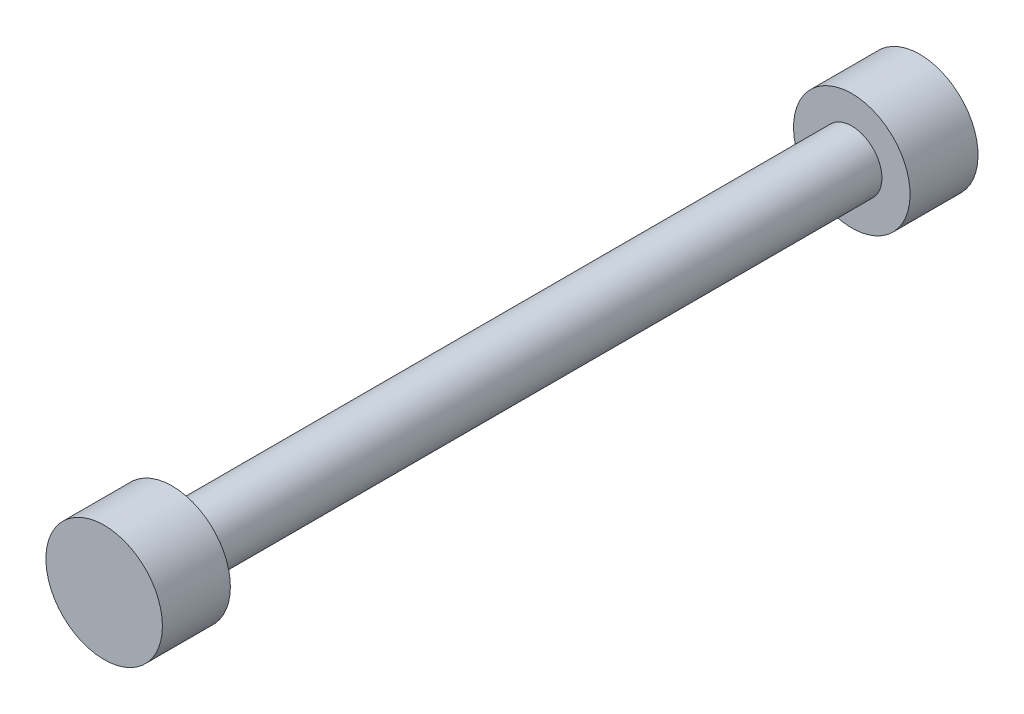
SolidWorks part; units mm, degrees
ref_plane "Front Plane" through (0, 0, 0) normal (0, 0, 1) x (1, 0, 0)
ref_plane "Top Plane" through (0, 0, 0) normal (0, 1, 0) x (1, 0, 0)
ref_plane "Right Plane" through (0, 0, 0) normal (1, 0, 0) x (0, 0, -1)
sketch "Sketch1" plane through (0, 0, 0) normal (0, 0, 1) x (1, 0, 0)
  circle A0 centre (0, 0) radius 9.525
extrude "Boss-Extrude1" add sketch "Sketch1" against normal up to surface (11.1125 mm away)
sketch "Sketch2" plane through (0, 0, -11.1125) normal (0, 0, -1) x (-1, 0, 0)
  circle A0 centre (0, 0) radius 4.9238
  dimension "D1" = 9.8476
extrude "Boss-Extrude2" add sketch "Sketch2" along normal up to surface (123.825 mm away)
ref_plane "Plane1" through (0, 0, -122.2375) normal (0, 0, -1) x (-1, 0, 0)
sketch "Sketch4" plane through (0, 0, -122.2375) normal (0, 0, -1) x (-1, 0, 0)
  circle A0 centre (0, 0) radius 9.525
  arc A1 (9.347, -1.8329) -> (6.2609, 7.1783) centre (0, 0) ccw construction
extrude "Boss-Extrude3" add sketch "Sketch4" along normal up to surface (11.1125 mm away)
